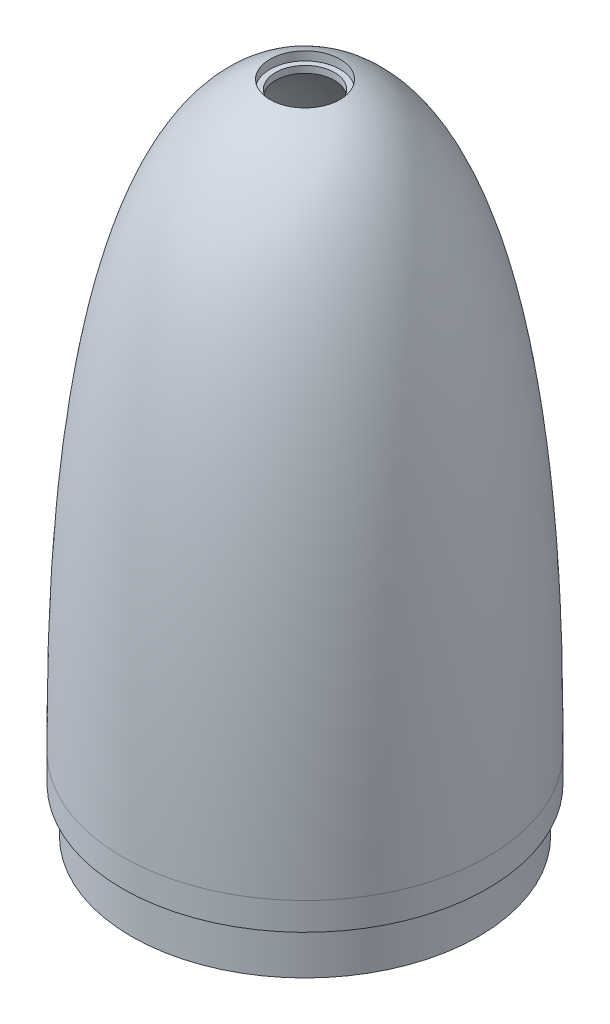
SolidWorks part; units mm, degrees
ref_plane "Front Plane" through (0, 0, 0) normal (0, 0, 1) x (1, 0, 0)
ref_plane "Top Plane" through (0, 0, 0) normal (0, 1, 0) x (1, 0, 0)
ref_plane "Right Plane" through (0, 0, 0) normal (1, 0, 0) x (0, 0, -1)
sketch "Sketch1" plane through (0, 0, 0) normal (0, 0, 1) x (1, 0, 0)
  line L10 (31.5, 0) -> (31.5, 8.3)
  line L11 (31.5, 8.3) -> (33.1, 8.3)
  line L12 (33.1, 8.3) -> (33.1, 13.3)
  line L13 (-1000, 120) -> (49000, 120) construction
  line L15 (25.7762, 120) -> (-27.328, 120) construction
  line L16 (30.1, 13.3) -> (30.1, 0)
  line L17 (0, 120) -> (0, 117)
  line L18 (30.1, 0) -> (31.5, 0)
  line L19 (28.5, 11.3) -> (30.1, 11.3) construction
  line L20 (28.5, 0) -> (28.5, 11.3) construction
  line L21 (30.1, 11.3) -> (30.1, 13.3) construction
  spline S0 degree 3 poles (0, 120) (32.5499, 120) (33.1, 40.9226) (33.1, 13.3) knots 0 0 0 0 1 1 1 1
  spline S1 degree 1 poles (0, 117) (30.1, 13.3) knots 0 0 1 1 construction
  spline S2 degree 3 poles (0, 117) (0.4241, 117) (1.2836, 116.9672) (2.9041, 116.7761) (4.8274, 116.3115) (6.9918, 115.4075) (9.7353, 113.7417) (12.9354, 110.7838) (16.3926, 105.8852) (19.4148, 99.8037) (22.8483, 90.3914) (26.0509, 76.711) (28.0204, 61.8446) (29.027, 50.031) (29.5417, 41.4052) (29.8611, 33.2078) (30.0023, 26.8937) (30.0631, 22.249) (30.0884, 18.9905) (30.0972, 16.4888) (30.0997, 14.6121) (30.1, 13.7431) (30.1, 13.3) knots 0 0 0 0 0.015625 0.03125 0.0625 0.09375 0.125 0.1875 0.25 0.3125 0.375 0.5 0.625 0.6875 0.75 0.8125 0.875 0.90625 0.9375 0.96875 0.984375 1 1 1 1
  point P5 (0, 137.6807)
  point P16 (0, 136.623)
  point P17 (0, 136.623)
  point P18 (0, 133.594)
  point P19 (0, 157.4602)
  dimension "D1" = 120
  dimension "D3" = 1.6
  dimension "D4" = 8.3
  dimension "D6" = 5
  dimension "D2" = 33.1
  dimension "D8" = 3
revolve "Revolve1" add sketch "Sketch1" angle 360 about L17
sketch "Sketch3" plane through (0, 0, 0) normal (0, 0, 1) x (1, 0, 0)
  line L0 (0, -1000) -> (0, 49000) construction
  line L1 (-31.5, 0) -> (31.5, 0) construction
  line L2 (0, 202.9742) -> (6.35, 202.9742)
  line L3 (6.35, 202.9742) -> (6.35, 117.3044)
  line L4 (6.35, 117.3044) -> (5.35, 117.3044)
  line L5 (5.35, 117.3044) -> (5.35, 41.718)
  line L6 (5.35, 41.718) -> (0, 41.718)
  line L7 (0, 41.718) -> (0, 202.9742)
  spline S0 degree 3 poles (33.1, 13.3) (33.1, 40.9226) (32.5499, 120) (0, 120) knots 0 0 0 0 1 1 1 1 construction
  point P5 (0, 0)
  point P11 (0, 0)
  point P13 (6.35, 118.8919)
  point P15 (0, 0)
  point P16 (0, 0)
  dimension "D1" = 12.7
  dimension "D2" = 1
  dimension "D3" = 1.5875
revolve "Cut-Revolve1" cut sketch "Sketch3" angle 360 about L0
